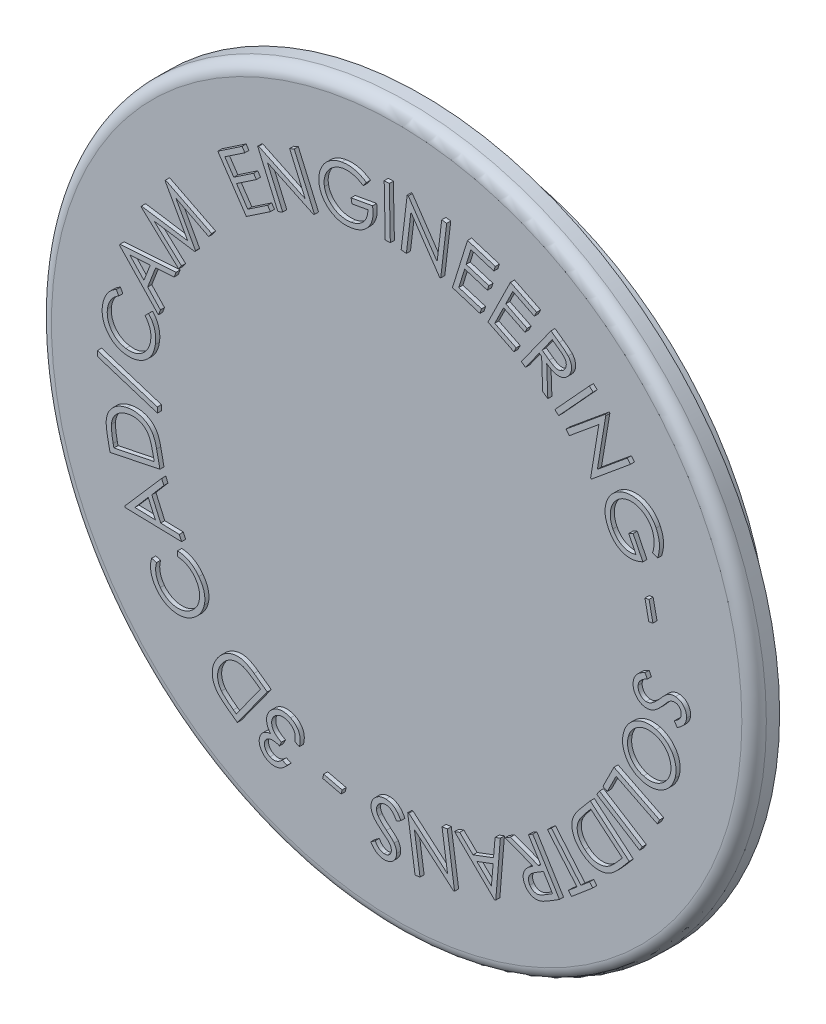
SolidWorks part; units mm, degrees
ref_plane "Front" through (0, 0, 0) normal (0, 0, 1) x (1, 0, 0)
ref_plane "Top" through (0, 0, 0) normal (0, 1, 0) x (1, 0, 0)
ref_plane "Right" through (0, 0, 0) normal (1, 0, 0) x (0, 0, -1)
sketch "Sketch1" plane through (0, 0, 0) normal (0, 0, 1) x (1, 0, 0)
  circle A0 centre (0, -38.1) radius 19.05 construction
  circle A1 centre (0, -38.1) radius 19.05
extrude "Extrude1" add sketch "Sketch1" against normal up to surface (2.54 mm away)
sketch "Sketch2" plane through (0, 0, 0) normal (0, 0, 1) x (1, 0, 0)
  circle A0 centre (0, -38.1) radius 22.225
  arc A1 (0, -15.875) -> (-1.0887, -60.2983) centre (0, -38.1) ccw construction
extrude "Extrude2" add sketch "Sketch2" along normal blind 1.5875
fillet "Fillet1" radius 0.762 1 edges at (22.225, -38.1, 1.5875)
sketch "Sketch3" plane through (0, 0, 1.5875) normal (0, 0, 1) x (1, 0, 0)
  circle A2 centre (0, -38.1) radius 15.113
  circle A3 centre (0, -38.1) radius 15.113 construction
  text T0 "SOLIDTRANS - 3D CAD/CAM  ENGINEERING -  " font "Century Gothic" height in points 12
  dimension "D1" = 6.35
extrude "Extrude3" add sketch "Sketch3" along normal blind 0.254
